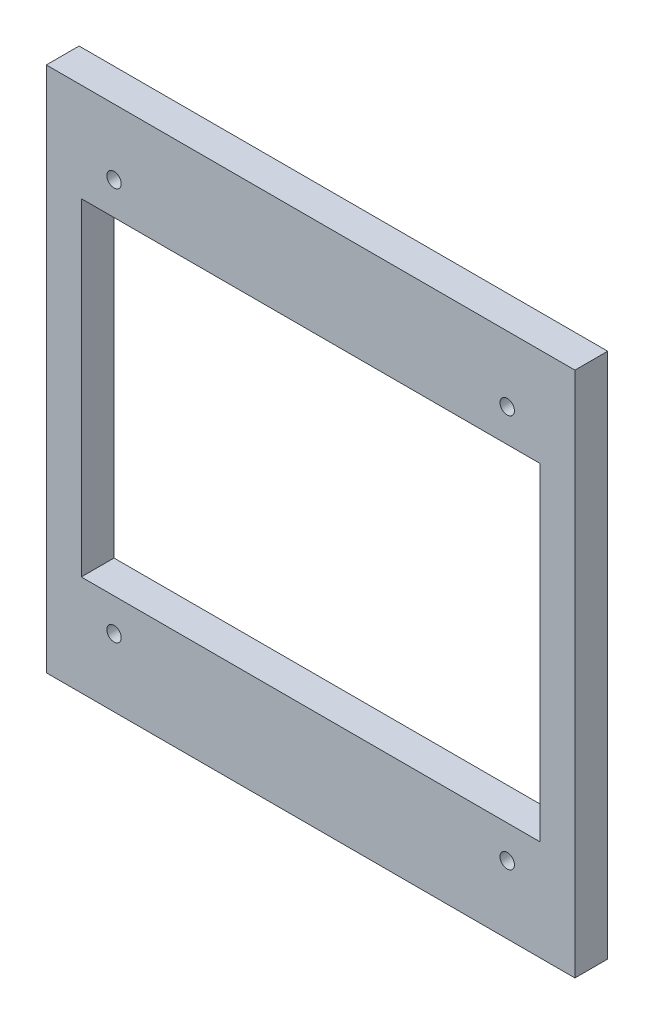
SolidWorks part; units mm, degrees
ref_plane "Front Plane" through (0, 0, 0) normal (0, 0, 1) x (1, 0, 0)
ref_plane "Top Plane" through (0, 0, 0) normal (0, 1, 0) x (1, 0, 0)
ref_plane "Right Plane" through (0, 0, 0) normal (1, 0, 0) x (0, 0, -1)
sketch "Sketch1" plane through (0, 0, 0) normal (0, 0, 1) x (1, 0, 0)
  line L1 (-2.54, -2.54) -> (612.14, -2.54)
  line L2 (-2.54, -2.54) -> (-2.54, 609.6)
  line L3 (-2.54, 609.6) -> (612.14, 609.6)
  line L4 (612.14, -2.54) -> (612.14, 609.6)
  line L5 (571.5, 495.3) -> (38.1, 495.3)
  line L6 (571.5, 495.3) -> (571.5, 114.3)
  line L7 (571.5, 114.3) -> (38.1, 114.3)
  line L8 (38.1, 495.3) -> (38.1, 114.3)
extrude "Extrude1" add sketch "Sketch1" along normal blind 38.1
sketch "Sketch2" plane through (0, 0, 0) normal (0, 0, -1) x (-1, 0, 0)
  circle A0 centre (-76.2, 76.2) radius 8.382
  circle A1 centre (-533.4, 76.2) radius 8.382
  circle A2 centre (-76.2, 533.4) radius 8.382
  circle A3 centre (-533.4, 533.4) radius 8.382
extrude "Cut-Extrude1" cut sketch "Sketch2" against normal through all
